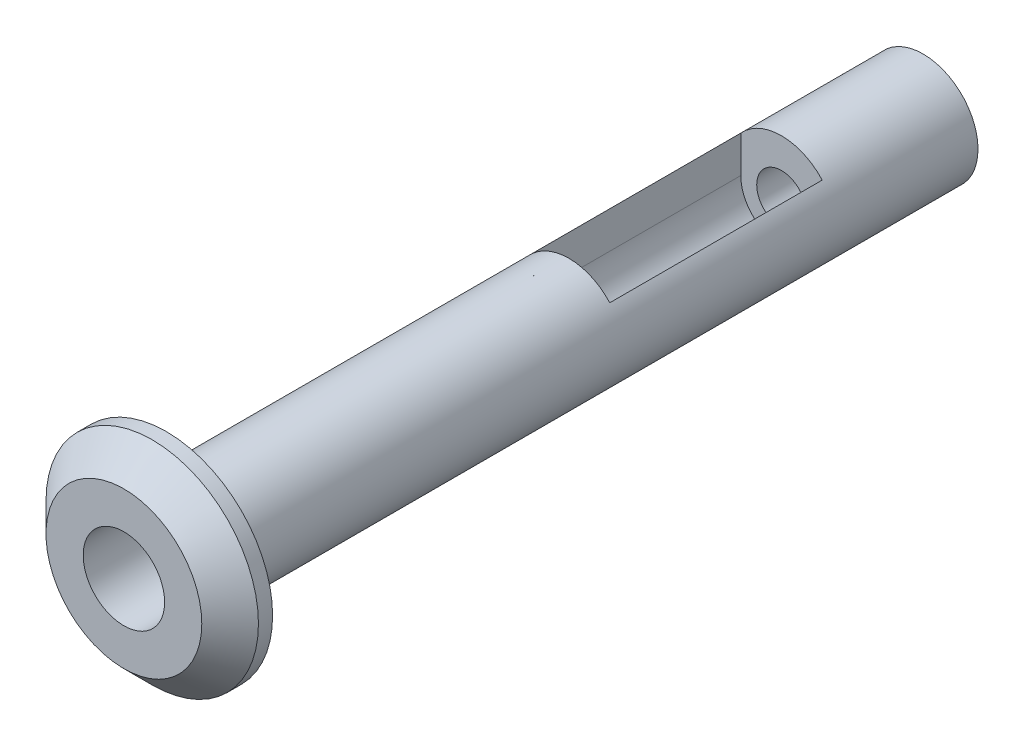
SolidWorks part; units mm, degrees
ref_plane "Alzado" through (0, 0, 0) normal (0, 0, 1) x (1, 0, 0)
ref_plane "Planta" through (0, 0, 0) normal (0, 1, 0) x (1, 0, 0)
ref_plane "Vista lateral" through (0, 0, 0) normal (1, 0, 0) x (0, 0, -1)
sketch "Croquis1" plane through (0, 0, 0) normal (0, 0, 1) x (1, 0, 0)
  circle A0 centre (0, 0) radius 7.5
  circle A1 centre (0, 0) radius 1.75
  dimension "D1" = 15
  dimension "D2" = 3.5
extrude "Saliente-Extruir1" add sketch "Croquis1" along normal mid plane 3
chamfer "Chaflán1" distance 2 angle 45 1 edges at (7.5, 0, 1.5)
sketch "Croquis2" plane through (0, 0, -1.5) normal (0, 0, -1) x (-1, 0, 0)
  circle A2 centre (0, 0) radius 1.75 construction
  circle A3 centre (0, 0) radius 1.75
  circle A4 centre (0, 0) radius 3.875
  dimension "D1" = 7.75
extrude "Saliente-Extruir2" add sketch "Croquis2" along normal blind 53.43
sketch "Croquis3" plane through (0, 0, 1.5) normal (0, 0, 1) x (1, 0, 0)
  circle A0 centre (0, 0) radius 2.875
  dimension "D1" = 5.75
extrude "Cortar-Extruir1" cut sketch "Croquis3" against normal offset from surface (46.43 mm away) 10
sketch "Croquis4" plane through (0, 0, -44.93) normal (0, 0, 1) x (1, 0, 0)
  line L2 (-1.75, 0) -> (-2.875, 0)
  line L3 (-2.875, 0) -> (-2.875, 2.5981)
  line L4 (1.75, 0) -> (2.875, 0)
  line L5 (2.875, 0) -> (2.875, 2.5981)
  circle A0 centre (0, 0) radius 2.875 construction
  circle A1 centre (0, 0) radius 2.875 construction
  arc A6 (-2.875, 2.5981) -> (2.875, 2.5981) centre (0, 0) ccw construction
  circle A7 centre (0, 0) radius 1.75 construction
  arc A8 (-2.875, 2.5981) -> (2.875, 2.5981) centre (0, 0) cw
  circle A9 centre (0, 0) radius 3.875 construction
  arc A10 (1.75, 0) -> (-1.75, 0) centre (0, 0) ccw
  arc A11 (-1.75, 0) -> (1.75, 0) centre (0, 0) ccw construction
extrude "Cortar-Extruir2" cut sketch "Croquis4" along normal blind 15
